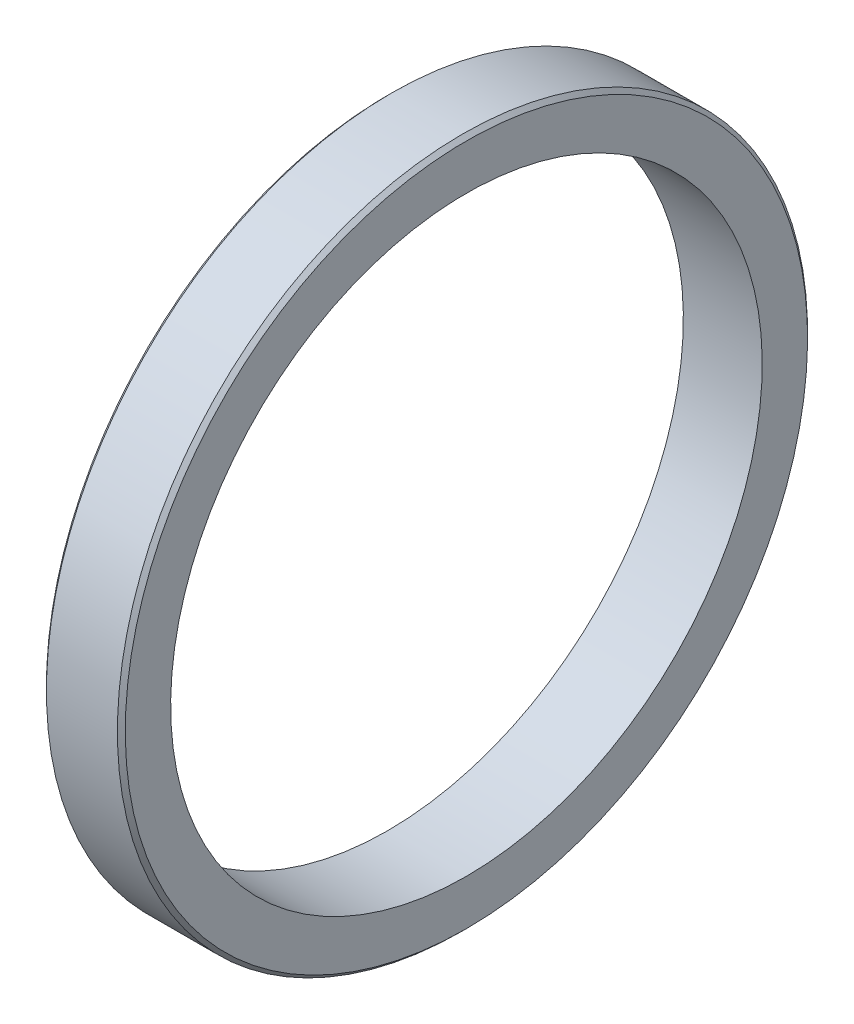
SolidWorks part; units mm, degrees
ref_plane "Front X-Y" through (0, 0, 0) normal (0, 0, 1) x (1, 0, 0)
ref_plane "Top X-Z" through (0, 0, 0) normal (0, 1, 0) x (1, 0, 0)
ref_plane "Right Y-Z" through (0, 0, 0) normal (1, 0, 0) x (0, 0, -1)
ref_plane "Plane1" through (0, 0, 0) normal (0, 0, 1) x (1, 0, 0)
sketch "Sketch1" plane through (0, 0, 0) normal (0, 0, 1) x (1, 0, 0)
  line L0 (0, 17.3) -> (0, 15)
  line L1 (0, 15) -> (4, 15)
  line L2 (4, 15) -> (4, 17.3)
  line L3 (4, 17.3) -> (3.8, 17.5)
  line L4 (3.8, 17.5) -> (0.2, 17.5)
  line L5 (0.2, 17.5) -> (0, 17.3)
  line L6 (4, 0) -> (0, 0) construction
  line L7 (2, 15) -> (2, 0) construction
  dimension "D1" = 30
  dimension "D2" = 35
  dimension "D3" = 4
  dimension "D4" = 0.2
  dimension "D5" = 45
revolve "Revolve1" add sketch "Sketch1" angle 360 about L6
